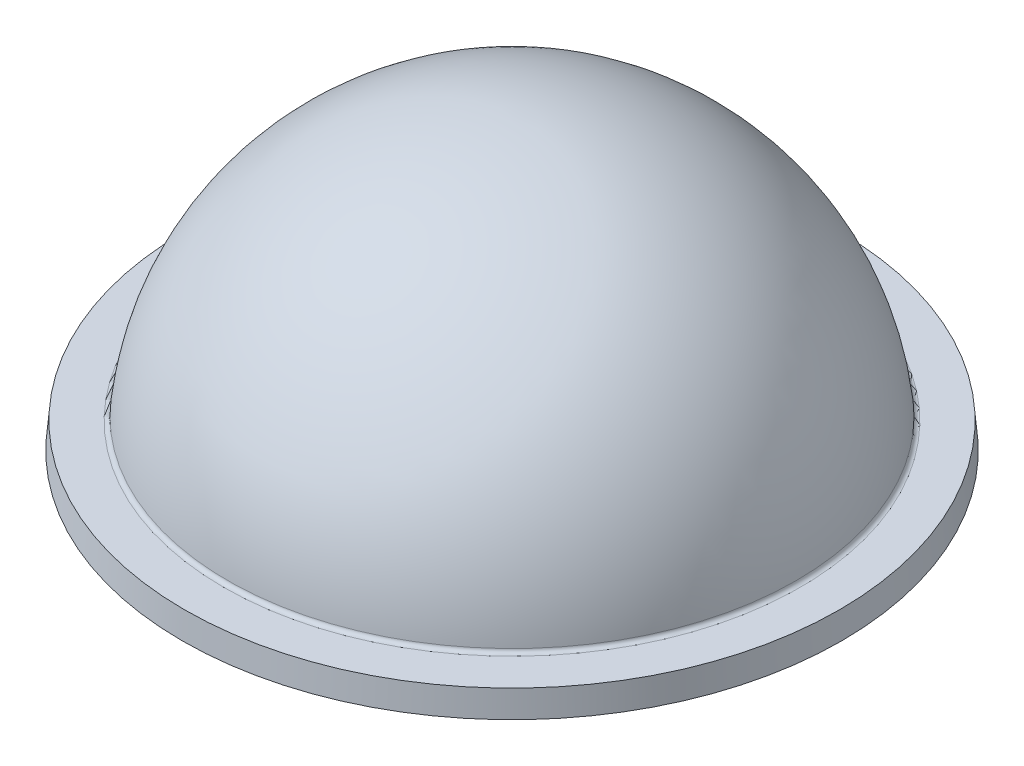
SolidWorks part; units mm, degrees
other "<WTE3-P-DOME-R1>-<Fillet2>"
ref_plane "Front Plane" through (0, 0, 0) normal (0, 0, 1) x (1, 0, 0)
ref_plane "Top Plane" through (0, 0, 0) normal (0, 1, 0) x (1, 0, 0)
ref_plane "Right Plane" through (0, 0, 0) normal (1, 0, 0) x (0, 0, -1)
inserted part "WTE3-P-DOME-R1"
